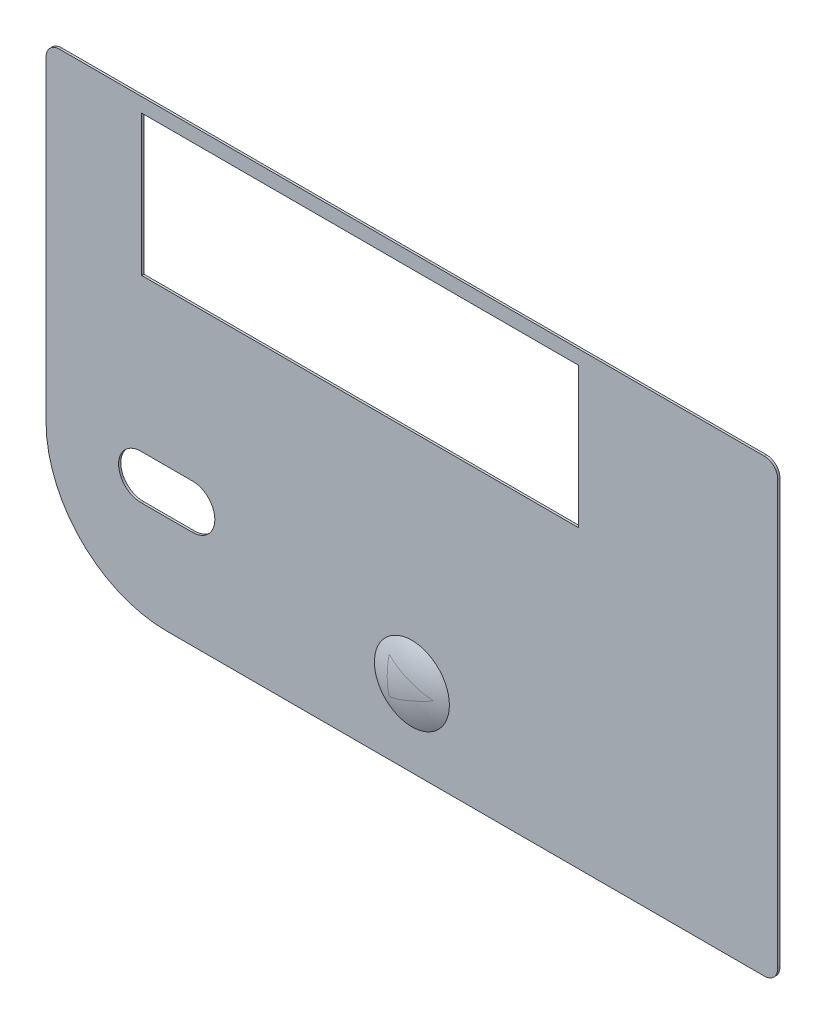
SolidWorks part; units mm, degrees
ref_plane "Vorne" through (0, 0, 0) normal (0, 0, 1) x (1, 0, 0)
ref_plane "Oben" through (0, 0, 0) normal (0, 1, 0) x (1, 0, 0)
ref_plane "Rechts" through (0, 0, 0) normal (1, 0, 0) x (0, 0, -1)
sketch "Skizze1" plane through (0, 0, 0) normal (0, 0, 1) x (1, 0, 0)
  line L1 (-47.625, 30.425) -> (47.625, 30.425)
  line L2 (-49.425, 28.625) -> (-49.425, -14.125)
  line L3 (-33.125, -30.425) -> (47.625, -30.425)
  line L4 (49.425, 28.625) -> (49.425, -28.625)
  arc A0 (-47.625, 30.425) -> (-49.425, 28.625) centre (-47.625, 28.625) ccw
  arc A1 (47.625, 30.425) -> (49.425, 28.625) centre (47.625, 28.625) cw
  arc A2 (47.625, -30.425) -> (49.425, -28.625) centre (47.625, -28.625) ccw
  arc A3 (-49.425, -14.125) -> (-33.125, -30.425) centre (-33.125, -14.125) ccw
  point P4 (0, 30.425)
  point P6 (49.425, 0)
  dimension "D1" = 1.8
  dimension "D2" = 16.3
  dimension "D3" = 98.85
  dimension "D4" = 60.85
extrude "Linear austragen1" add sketch "Skizze1" against normal blind 0.3
sketch "Skizze2" plane through (0, 0, 0) normal (0, 0, 1) x (1, 0, 0)
  line L1 (-36.625, -11.1248) -> (-29.625, -11.1248)
  line L3 (-36.4881, -17.1248) -> (-29.625, -17.1248)
  arc A0 (-29.625, -17.1248) -> (-29.625, -11.1248) centre (-29.625, -14.1248) ccw
  arc A1 (-36.625, -11.1248) -> (-36.4881, -17.1248) centre (-36.625, -14.1263) ccw
  point P0 (-33.125, -14.125)
  point P6 (-33.125, -11.1248)
  dimension "D2" = 7
  dimension "D1" = 6
extrude "Linear austragen2" cut sketch "Skizze2" against normal blind 10
sketch "Skizze4" plane through (0, 0, -0.3) normal (0, 0, -1) x (-1, 0, 0)
  line L1 (-22.5, 9.5) -> (-22.5, 28.5)
  line L3 (36.5, 9.5) -> (-22.5, 9.5)
  line L5 (-22.5, 28.5) -> (36.5, 28.5)
  line L7 (36.5, 28.5) -> (36.5, 9.5)
  dimension "D1" = 9.5
  dimension "D2" = 19
  dimension "D3" = 59
  dimension "D4" = 22.5
extrude "Linear austragen3" cut sketch "Skizze4" against normal blind 10
sketch "Skizze5" plane through (0, 0, 0) normal (1, 0, 0) x (0, 0, -1)
  line L0 (0.3, -15) -> (0.3, -20)
  line L1 (0.3, 28.625) -> (0.3, -14.125) construction
  line L2 (0.3, -17.1248) -> (0.3, -11.1248) construction
  line L3 (0.3, -20) -> (-0.7913, -20)
  arc A0 (-0.7913, -20) -> (0.3, -15) centre (11.2087, -20) cw
  dimension "D3" = 12
  dimension "D1" = 20
  dimension "D2" = 5
revolve "Rotation1" add sketch "Skizze5" angle 360 about L3
other "Einbuchtung1" parameters "D1"=0.3, "D2"=0
ref_plane "Ebene1" through (0, 0, 10) normal (0, 0, 1) x (1, 0, 0)
sketch "Skizze8" plane through (0, 0, 10) normal (0, 0, 1) x (1, 0, 0)
  line L0 (3.5, -20) -> (-2.5, -17.5147)
  line L1 (-2.5, -17.5147) -> (-2.5, -22.4853)
  line L2 (-2.5, -22.4853) -> (3.5, -20)
  line L3 (3.5, -20) -> (-2.5, -20) construction
  dimension "D1" = 6
  dimension "D2" = 20
  dimension "D3" = 45
  dimension "D4" = 3.5
